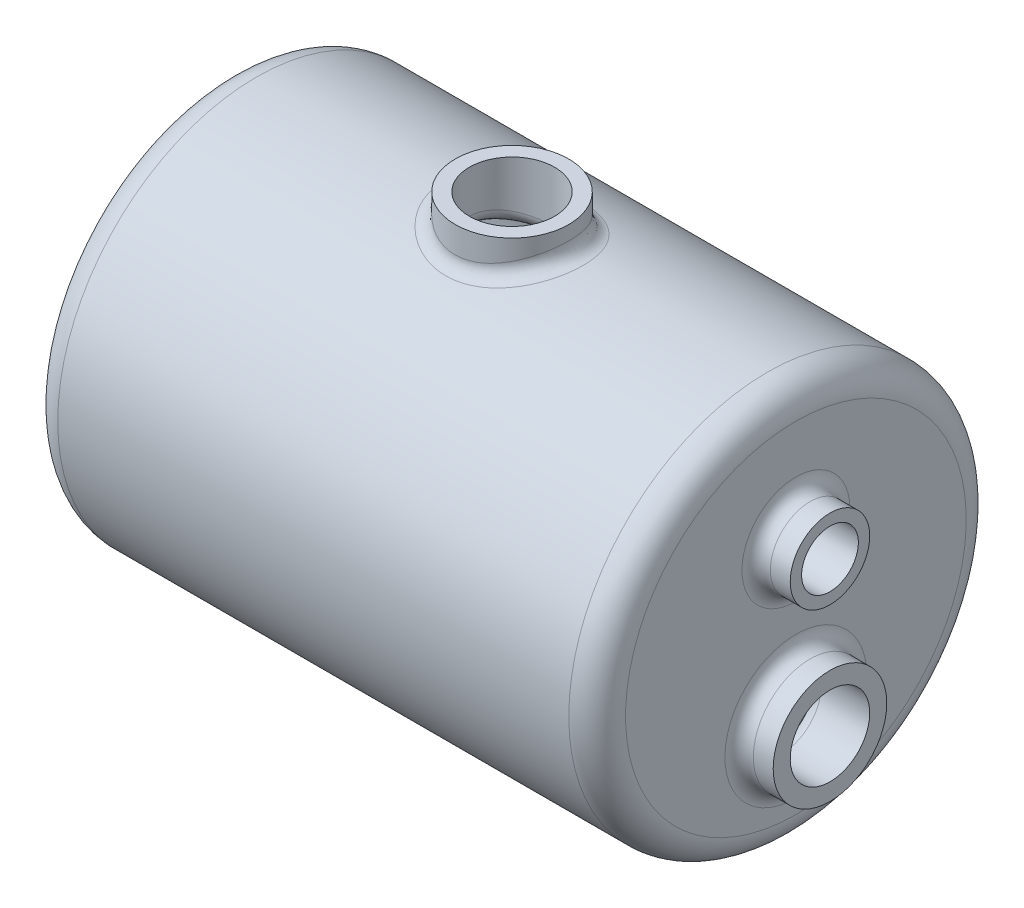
SolidWorks part; units mm, degrees
ref_plane "Front Plane" through (0, 0, 0) normal (0, 0, 1) x (1, 0, 0)
ref_plane "Top Plane" through (0, 0, 0) normal (0, 1, 0) x (1, 0, 0)
ref_plane "Right Plane" through (0, 0, 0) normal (1, 0, 0) x (0, 0, -1)
sketch "Sketch1" plane through (0, 0, 0) normal (0, 0, 1) x (1, 0, 0)
  line L0 (0, 70.2658) -> (0, -27.3025) construction
  line L1 (-250, 0) -> (250, 0)
  line L2 (-250, 0) -> (-250, 175)
  line L3 (-250, 175) -> (250, 175)
  line L4 (250, 0) -> (250, 175)
  line L5 (-69.0185, 0) -> (72.6218, 0) construction
  dimension "D1" = 175
  dimension "D2" = 500
revolve "Revolve1" add sketch "Sketch1" angle 360 about L1
fillet "Fillet1" radius 25 2 edges at (-250, -175, 0) (250, -175, 0)
shell "Shell1" thickness 25
ref_plane "Plane1" through (0, 200, 0) normal (0, 1, 0) x (-1, 0, 0)
sketch "Sketch2" plane through (0, 200, 0) normal (0, 1, 0) x (-1, 0, 0)
  line L0 (250, -150) -> (250, 150) construction
  circle A0 centre (0, 0) radius 50
  dimension "D1" = 100
  dimension "D2" = 250
extrude "Extrude1" add sketch "Sketch2" against normal up to surface (32.2949 mm away)
sketch "Sketch4" plane through (0, 200, 0) normal (0, 1, 0) x (-1, 0, 0)
  circle A0 centre (0, 0) radius 37.5
  dimension "D1" = 75
extrude "Cut-Extrude1" cut sketch "Sketch4" against normal up to next
sketch "Sketch5" plane through (250, 0, 0) normal (1, 0, 0) x (0, 0, -1)
  circle A0 centre (0, 60) radius 35
  circle A1 centre (0, -75) radius 50
  dimension "D1" = 70
  dimension "D2" = 100
  dimension "D3" = 75
  dimension "D4" = 60
extrude "Extrude2" add sketch "Sketch5" along normal blind 30
sketch "Sketch6" plane through (280, 0, 0) normal (1, 0, 0) x (0, 0, -1)
  circle A0 centre (0, -75) radius 35
  circle A1 centre (0, 60) radius 25
  circle A2 centre (0, 60) radius 35 construction
  circle A3 centre (0, -75) radius 50 construction
  dimension "D1" = 50
  dimension "D2" = 70
extrude "Cut-Extrude2" cut sketch "Sketch6" against normal up to next
fillet "Internal Tank Fillets" radius 12.5 2 edges at (-225, 150, 0) (225, -150, 0)
fillet "Pipe Connection Fillets" radius 12.5 6 edges at (-9.2932, 167.9624, -49.1288) (-7.3445, 145.4225, -36.7738) (250, 25, 0) (250, -125, 0) (225, -110, 0) (225, 35, 0)
sketch "Sketch7" plane through (0, 0, 0) normal (1, 0, 0) x (0, 0, -1)
  line L0 (0, -193.4804) -> (0, 264.8529)
extrude "Half-Model of Cylinder" [suppressed] cut sketch "Sketch7" against normal through all and the other way through all flip side to cut
